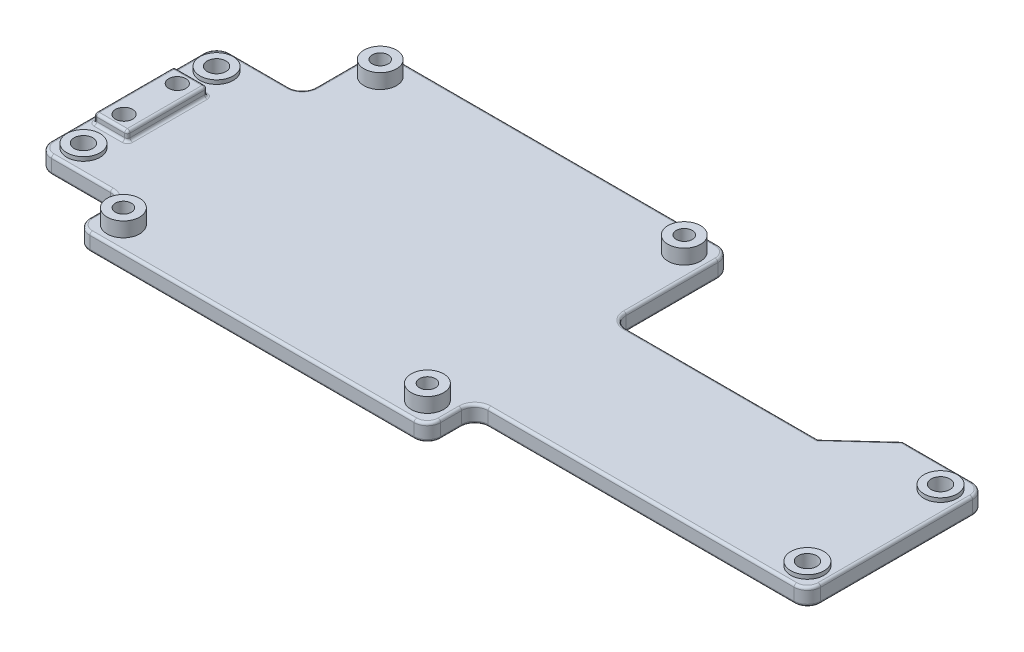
SolidWorks part; units mm, degrees
ref_plane "Front Plane" through (0, 0, 0) normal (0, 0, 1) x (1, 0, 0)
ref_plane "Top Plane" through (0, 0, 0) normal (0, 1, 0) x (1, 0, 0)
ref_plane "Right Plane" through (0, 0, 0) normal (1, 0, 0) x (0, 0, -1)
sketch "Sketch1" plane through (0, 0, 0) normal (0, 1, 0) x (1, 0, 0)
  line L0 (27.2099, 48.968) -> (85.2099, 48.968) construction
  line L1 (27.2099, 48.968) -> (27.2099, -0.032) construction
  line L2 (27.2099, -0.032) -> (85.2099, -0.032) construction
  line L3 (85.2099, 48.968) -> (85.2099, -0.032) construction
  line L4 (6.3819, 34.258) -> (8.9219, 34.258) construction
  line L5 (10.6999, 34.258) -> (148.8124, 34.258) construction
  line L6 (10.6999, 34.258) -> (10.6999, 8.858) construction
  line L7 (10.6999, 8.858) -> (148.8124, 8.858) construction
  line L8 (148.8124, 34.258) -> (148.8124, 8.858) construction
  line L9 (6.3819, 38.576) -> (22.7395, 38.576)
  line L10 (6.3819, 38.576) -> (6.3819, 4.54)
  line L11 (6.3819, 4.54) -> (22.7395, 4.54)
  line L12 (153.1304, 38.576) -> (153.1304, 4.54)
  line L13 (10.6999, 36.036) -> (10.6999, 38.576) construction
  line L14 (10.6999, 7.08) -> (10.6999, 4.54) construction
  line L15 (150.5904, 8.858) -> (153.1304, 8.858) construction
  line L16 (27.2099, -0.032) -> (27.2099, 8.858) construction
  line L17 (27.2099, 48.968) -> (27.2099, 34.258) construction
  line L18 (22.7395, 38.576) -> (22.7395, 53.4384)
  line L19 (22.7395, 53.4384) -> (89.6803, 53.4384)
  line L20 (89.6803, 53.4384) -> (89.6803, 38.576)
  line L21 (22.7395, 4.54) -> (22.7395, -4.5024)
  line L22 (22.7395, -4.5024) -> (89.6803, -4.5024)
  line L23 (89.6803, -4.5024) -> (89.6803, 4.54)
  line L24 (27.2099, 50.8984) -> (27.2099, 53.4384) construction
  line L25 (27.2099, -1.9624) -> (27.2099, -4.5024) construction
  line L26 (25.2795, -0.032) -> (22.7395, -0.032) construction
  line L27 (87.1403, -0.032) -> (89.6803, -0.032) construction
  line L28 (89.6803, 4.54) -> (153.1304, 4.54)
  line L29 (89.6803, 38.576) -> (153.1304, 38.576)
  circle A0 centre (27.2099, 48.968) radius 1.9304
  circle A1 centre (85.2099, 48.968) radius 1.9304
  circle A2 centre (85.2099, -0.032) radius 1.9304
  circle A3 centre (27.2099, -0.032) radius 1.9304
  circle A4 centre (10.6999, 34.258) radius 1.778
  circle A5 centre (10.6999, 8.858) radius 1.778
  circle A6 centre (148.8124, 8.858) radius 1.778
  circle A7 centre (148.8124, 34.258) radius 1.778
  dimension "D1" = 3.8608
  dimension "D4" = 3.556
  dimension "D2" = 49
  dimension "D3" = 58
  dimension "D5" = 2.54
  dimension "D6" = 25.4
  dimension "D7" = 138.1125
  dimension "D8" = 2.54
  dimension "D9" = 16.51
  dimension "D10" = 8.89
extrude "Boss-Extrude1" add sketch "Sketch1" along normal blind 3.302
sketch "Sketch2" plane through (0, 3.302, 0) normal (0, 1, 0) x (1, 0, 0)
  circle A0 centre (27.2099, 48.968) radius 3.1
  circle A1 centre (85.2099, 48.968) radius 3.1
  circle A2 centre (27.2099, -0.032) radius 3.1
  circle A3 centre (85.2099, -0.032) radius 3.1
  circle A4 centre (27.2099, 48.968) radius 1.52
  circle A5 centre (85.2099, 48.968) radius 1.52
  circle A6 centre (85.2099, -0.032) radius 1.52
  circle A7 centre (27.2099, -0.032) radius 1.52
  dimension "D1" = 6.2
  dimension "D2" = 3.04
extrude "Boss-Extrude2" add sketch "Sketch2" along normal blind 2.794
sketch "Sketch3" plane through (0, 3.302, 0) normal (0, 1, 0) x (1, 0, 0)
  line L0 (10.8269, 13.938) -> (10.8269, 4.54) construction
  line L1 (7.6519, 29.178) -> (14.0019, 29.178)
  line L2 (7.6519, 29.178) -> (7.6519, 13.938)
  line L3 (7.6519, 13.938) -> (14.0019, 13.938)
  line L4 (14.0019, 29.178) -> (14.0019, 13.938)
  line L5 (6.3819, 4.54) -> (22.7395, 4.54) construction
  line L6 (10.8269, 29.178) -> (10.8269, 38.576) construction
  line L7 (22.7395, 38.576) -> (6.3819, 38.576) construction
  line L8 (6.3819, 38.576) -> (6.3819, 4.54) construction
  dimension "D1" = 6.35
  dimension "D2" = 15.24
  dimension "D3" = 1.27
extrude "Boss-Extrude3" add sketch "Sketch3" along normal blind 1.778
hole_wizard "#4 Clearance Hole1" positions "Sketch4" profile "Sketch5" hole size "#4" standard "ANSI Inch"
sketch "Sketch4" plane through (0, 5.08, 0) normal (0, 1, 0) x (1, 0, 0)
  line L5 (10.8269, 26.638) -> (10.8269, 29.178) construction
  line L6 (14.0019, 29.178) -> (7.6519, 29.178) construction
  line L8 (10.8269, 16.478) -> (10.8269, 13.938) construction
  line L9 (7.6519, 13.938) -> (14.0019, 13.938) construction
  point P0 (10.8269, 26.638)
  point P2 (10.8269, 16.478)
  dimension "D1" = 10.16
sketch "Sketch5" plane through (10.8269, 5.08, -26.638) normal (1, 0, 0) x (0, 0, 1)
  line L0 (0, 0) -> (0, 5.08)
  line L1 (0, 5.08) -> (1.6319, 5.08)
  line L2 (1.6319, 5.08) -> (1.6319, 0)
  line L5 (1.6319, 0) -> (0, 0)
  line L11 (0, -6.35) -> (0, 107.95) construction
  dimension "Thru Hole Dia." = 3.2639
  dimension "Thru Hole Depth" = 5.08
sketch "Sketch8" plane through (0, 3.302, 0) normal (0, 1, 0) x (1, 0, 0)
  line L4 (89.6803, 38.576) -> (89.6803, 30.8728)
  line L5 (89.6803, 30.8728) -> (128.8426, 30.8728)
  line L6 (128.8426, 30.8728) -> (137.2727, 38.576)
  line L7 (153.1304, 38.576) -> (89.6803, 38.576) construction
  line L8 (137.2727, 38.576) -> (89.6803, 38.576)
extrude "Cut-Extrude5" cut sketch "Sketch8" against normal blind 25.025
sketch "Sketch10" plane through (0, 0, 0) normal (0, -1, 0) x (1, 0, 0)
  circle A0 centre (27.2099, 0.032) radius 1.9304
  circle A1 centre (85.2099, 0.032) radius 1.9304
  circle A2 centre (85.2099, -48.968) radius 1.9304
  circle A3 centre (27.2099, -48.968) radius 1.9304
extrude "Cut-Extrude6" cut sketch "Sketch10" against normal blind 3.5
fillet "Fillet1" radius 2.54 1 edges at (6.3819, 1.651, -4.54)
fillet "Fillet2" radius 2.54 1 edges at (6.3819, 1.651, -38.576)
fillet "Fillet3" radius 2.54 1 edges at (22.7395, 1.651, -4.54)
fillet "Fillet4" radius 2.54 1 edges at (22.7395, 1.651, 4.5024)
fillet "Fillet5" radius 2.54 1 edges at (22.7395, 1.651, -38.576)
fillet "Fillet6" radius 2.54 1 edges at (22.7395, 1.651, -53.4384)
fillet "Fillet7" radius 2.54 1 edges at (89.6803, 1.651, -53.4384)
fillet "Fillet8" radius 2.54 1 edges at (89.6803, 1.651, -30.8728)
fillet "Fillet9" radius 2.54 1 edges at (153.1304, 1.651, -38.576)
fillet "Fillet10" radius 2.54 1 edges at (153.1304, 1.651, -4.54)
fillet "Fillet11" radius 2.54 1 edges at (89.6803, 1.651, -4.54)
fillet "Fillet12" radius 2.54 1 edges at (89.6803, 1.651, 4.5024)
fillet "Fillet13" radius 0.508 64 edges at (10.8269, 3.302, -13.938) (7.6519, 3.302, -21.558) (110.5314, 0, -30.8728) (90.4243, 0, -31.6167) (89.6803, 0, -42.1556) (88.9364, 0, -52.6944) (56.2099, 0, -53.4384) (23.4835, 0, -52.6944) (22.7395, 0, -46.0072) (21.9956, 0, -39.3199) (14.5607, 0, -38.576) (7.1259, 0, -37.832) (6.3819, 0, -21.558) (7.1259, 0, -5.2839) (14.5607, 0, -4.54) (143.9316, 0, -38.576) (152.3865, 0, -37.832) (153.1304, 0, -21.558) (152.3865, 0, -5.2839) (121.4054, 0, -4.54) (90.4243, 0, -3.796) (89.6803, 0, -0.0188) (88.9364, 0, 3.7585) (56.2099, 0, 4.5024) (23.4835, 0, 3.7585) (22.7395, 0, -0.0188) (110.5314, 3.302, -30.8728) (90.4243, 3.302, -31.6167) (89.6803, 3.302, -42.1556) (88.9364, 3.302, -52.6944) (56.2099, 3.302, -53.4384) (23.4835, 3.302, -52.6944) (22.7395, 3.302, -46.0072) (21.9956, 3.302, -39.3199) (14.5607, 3.302, -38.576) (7.1259, 3.302, -37.832) (143.9316, 3.302, -38.576) (152.3865, 3.302, -37.832) (153.1304, 3.302, -21.558) (152.3865, 3.302, -5.2839) (121.4054, 3.302, -4.54) (90.4243, 3.302, -3.796) (89.6803, 3.302, -0.0188) (88.9364, 3.302, 3.7585) (56.2099, 3.302, 4.5024) (23.4835, 3.302, 3.7585) (22.7395, 3.302, -0.0188) (21.9956, 3.302, -3.796) (14.5607, 3.302, -4.54) (7.1259, 3.302, -5.2839) (14.0019, 4.191, -13.938) (14.0019, 5.08, -21.558) (14.0019, 3.302, -21.558) (14.0019, 4.191, -29.178) (10.8269, 5.08, -29.178) (7.6519, 4.191, -29.178) (10.8269, 3.302, -29.178) (133.0576, 0, -34.7244) (133.0576, 3.302, -34.7244) (21.9956, 0, -3.796) (7.6519, 4.191, -13.938) (10.8269, 5.08, -13.938) (7.6519, 5.08, -21.558) (6.3819, 3.302, -21.558)
sketch "Sketch11" plane through (0, 3.302, 0) normal (0, 1, 0) x (1, 0, 0)
  circle A0 centre (10.6999, 34.258) radius 3.175
  circle A1 centre (10.6999, 8.858) radius 3.175
  circle A2 centre (148.8124, 34.258) radius 3.175
  circle A3 centre (148.8124, 8.858) radius 3.175
  circle A4 centre (10.6999, 34.258) radius 1.778
  circle A5 centre (10.6999, 8.858) radius 1.778
  circle A6 centre (148.8124, 8.858) radius 1.778
  circle A7 centre (148.8124, 34.258) radius 1.778
  dimension "D1" = 6.35
  dimension "D2" = 3.556
extrude "Boss-Extrude4" add sketch "Sketch11" along normal blind 0.762
